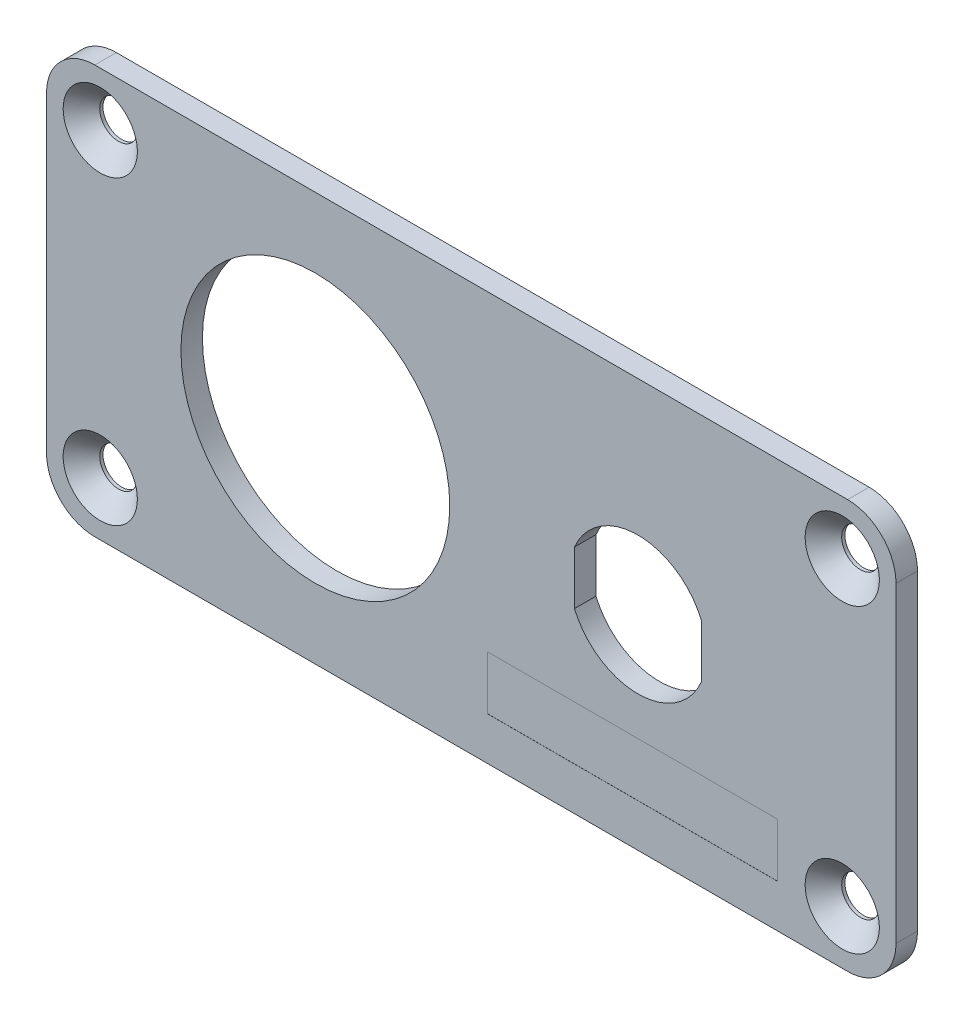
SolidWorks part; units mm, degrees
ref_plane "Alzado" through (0, 0, 0) normal (0, 0, 1) x (1, 0, 0)
ref_plane "Planta" through (0, 0, 0) normal (0, 1, 0) x (1, 0, 0)
ref_plane "Vista lateral" through (0, 0, 0) normal (1, 0, 0) x (0, 0, -1)
sketch "Croquis1" plane through (0, 0, 0) normal (0, 0, 1) x (1, 0, 0)
  line L1 (0, 0) -> (79, 0)
  line L2 (0, 0) -> (0, 38)
  line L3 (0, 38) -> (79, 38)
  line L4 (79, 0) -> (79, 38)
  dimension "D1" = 38
  dimension "D2" = 79
extrude "Saliente-Extruir1" add sketch "Croquis1" along normal blind 2
fillet "Redondeo1" radius 4.5 4 edges at (79, 0, 1) (79, 38, 1) (0, 38, 1) (0, 0, 1)
sketch "Croquis2" plane through (0, 0, 2) normal (0, 0, 1) x (1, 0, 0)
  line L0 (79, 19) -> (-9.858, 19) construction
  line L1 (74, 5) -> (5, 5) construction
  line L2 (39.5, 38) -> (39.5, 28.7382) construction
  line L4 (5, 33) -> (74, 33) construction
  line L5 (74, 33) -> (74, 5) construction
  line L6 (5, 5) -> (5, 33) construction
  line L7 (79, 4.5) -> (79, 33.5) construction
  line L8 (74.5, 38) -> (4.5, 38) construction
  circle A0 centre (5, 33) radius 1.75
  circle A1 centre (5, 5) radius 1.75
  circle A2 centre (74, 33) radius 1.75
  circle A3 centre (74, 5) radius 1.75
  point P15 (79, 19)
  point P18 (39.5, 38)
  point P19 (74, 19)
  point P20 (39.5, 33)
  dimension "D1" = 3.5
  dimension "D3" = 69
  dimension "D2" = 28
extrude "Cortar-Extruir1" cut sketch "Croquis2" against normal through all
sketch "Croquis3" plane through (0, 0, 2) normal (0, 0, 1) x (1, 0, 0)
  line L0 (49.1, 21.4799) -> (49.1, 16.5201)
  line L1 (60.9, 21.4799) -> (60.9, 16.5201)
  line L2 (93.0877, 19) -> (-4.234, 19) construction
  line L3 (79, 4.5) -> (79, 33.5) construction
  circle A0 centre (25, 19) radius 12.5
  circle A1 centre (5, 5) radius 1.75 construction
  arc A2 (49.1, 16.5201) -> (60.9, 16.5201) centre (55, 19) ccw
  arc A3 (60.9, 21.4799) -> (49.1, 21.4799) centre (55, 19) ccw
  point P13 (79, 19)
  dimension "D2" = 25
  dimension "D3" = 30
  dimension "D5" = 6.4
  dimension "D1" = 20
  dimension "D4" = 11.8
  dimension "D6" = 5.9
extrude "Cortar-Extruir2" cut sketch "Croquis3" against normal blind 2
chamfer "Chaflán1" distance 1.7 angle 45 4 edges at (75.75, 33, 2) (75.75, 5, 2) (6.75, 5, 2) (6.75, 33, 2)
sketch "Croquis5" plane through (0, 0, 2) normal (0, 0, 1) x (1, 0, 0)
  line L0 (1.1, 0) -> (-1.1, 0) construction
  line L1 (41, 9) -> (68, 9)
  line L2 (41, 9) -> (41, 4)
  line L3 (41, 4) -> (68, 4)
  line L4 (68, 9) -> (68, 4)
  line L5 (79, 4.5) -> (79, 33.5) construction
  dimension "D1" = 5
  dimension "D2" = 27
  dimension "D3" = 4
  dimension "D4" = 11
extrude "Cortar-Extruir3" cut sketch "Croquis5" against normal blind 0.01
